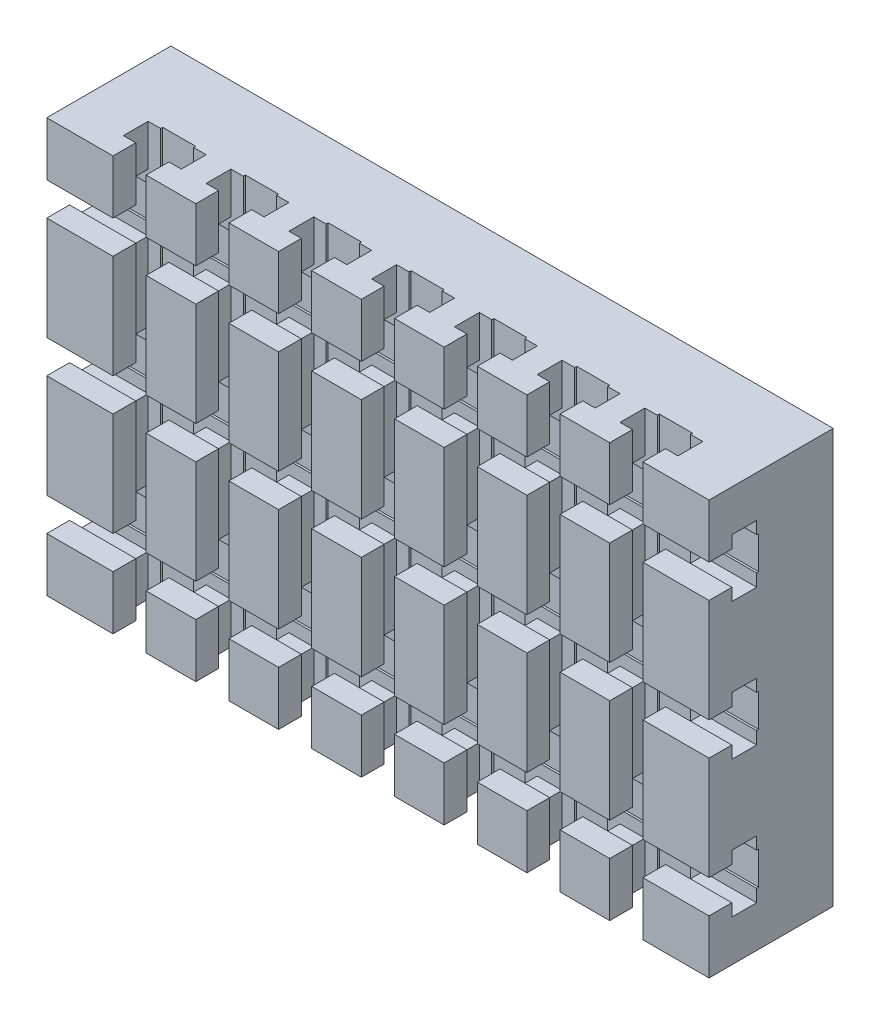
SolidWorks part; units mm, degrees
ref_plane "Front Plane" through (0, 0, 0) normal (0, 0, 1) x (1, 0, 0)
ref_plane "Top Plane" through (0, 0, 0) normal (0, 1, 0) x (1, 0, 0)
ref_plane "Right Plane" through (0, 0, 0) normal (1, 0, 0) x (0, 0, -1)
sketch "Sketch1" plane through (0, 0, 0) normal (0, 0, 1) x (1, 0, 0)
  line L1 (-80, -50) -> (80, -50)
  line L2 (-80, -50) -> (-80, 50)
  line L3 (-80, 50) -> (80, 50)
  line L4 (80, -50) -> (80, 50)
  line L5 (-80, -50) -> (80, 50) construction
  line L6 (-80, 50) -> (80, -50) construction
  point P0 (0, 0)
  dimension "D1" = 160
  dimension "D2" = 100
extrude "Boss-Extrude1" add sketch "Sketch1" along normal blind 30
sketch "Sketch2" plane through (80, 0, 0) normal (1, 0, 0) x (0, 0, -1)
  line L0 (-30, -50) -> (-30, 50) construction
  line L1 (-30, -37) -> (-18, -37)
  line L2 (-30, -37) -> (-30, -29)
  line L3 (-30, -29) -> (-18, -29)
  line L4 (-18, -37) -> (-18, -29)
  line L5 (-30, -4) -> (-18, -4)
  line L6 (-30, -4) -> (-30, 4)
  line L7 (-30, 4) -> (-18, 4)
  line L8 (-18, -4) -> (-18, 4)
  line L9 (-30, 29) -> (-18, 29)
  line L10 (-30, 29) -> (-30, 37)
  line L11 (-30, 37) -> (-18, 37)
  line L12 (-18, 29) -> (-18, 37)
  line L13 (0, 0) -> (-18, 0) construction
  line L14 (-18, -33) -> (-21.5, -33) construction
  line L15 (-24.5, -7) -> (-18.5, -7)
  line L16 (-24.5, -40) -> (-18.5, -40)
  line L17 (-24.5, -40) -> (-24.5, -26)
  line L18 (-24.5, -26) -> (-18.5, -26)
  line L19 (-18.5, -40) -> (-18.5, -26)
  line L20 (-24.5, -40) -> (-18.5, -26) construction
  line L21 (-24.5, -26) -> (-18.5, -40) construction
  line L22 (-18.5, -7) -> (-18.5, 7)
  line L23 (-24.5, 7) -> (-18.5, 7)
  line L24 (-24.5, -7) -> (-24.5, 7)
  line L25 (-24.5, 26) -> (-18.5, 26)
  line L26 (-18.5, 26) -> (-18.5, 40)
  line L27 (-24.5, 40) -> (-18.5, 40)
  line L28 (-24.5, 26) -> (-24.5, 40)
  point P23 (0, 0)
  dimension "D1" = 8
  dimension "D3" = 12
  dimension "D4" = 25
  dimension "D5" = 14
  dimension "D6" = 6
  dimension "D7" = 0.5
  dimension "D2" = 3
  dimension "D8" = 3
extrude "Cut-Extrude1" cut sketch "Sketch2" against normal through all contours L1 L17 L3 M10 | L1 L19 L3 L17 | L16 L19 L1 L17 | L3 L19 L18 L17 | L19 L1 L4 L3 | L24 L5 L22 L7 | L24 L15 L22 L5 | L5 L24 L7 M10 | L24 L7 L22 L23 | L22 L5 L8 L7 | L28 L25 L26 L9 | L28 L9 L26 L11 | L26 L9 L12 L11 | L9 L28 L11 M10 | L28 L11 L26 L27
sketch "Sketch3" plane through (0, -50, 0) normal (0, -1, 0) x (1, 0, 0)
  line L0 (-80, 30) -> (80, 30) construction
  line L1 (-4, 18) -> (4, 18)
  line L2 (-4, 18) -> (-4, 30)
  line L3 (-4, 30) -> (4, 30)
  line L4 (4, 18) -> (4, 30)
  line L5 (-4, 18) -> (4, 30) construction
  line L6 (-4, 30) -> (4, 18) construction
  line L7 (0, 18) -> (0, 21.5) construction
  line L9 (-7, 18.5) -> (7, 18.5)
  line L10 (-7, 18.5) -> (-7, 24.5)
  line L11 (-7, 24.5) -> (7, 24.5)
  line L12 (7, 18.5) -> (7, 24.5)
  line L13 (-7, 18.5) -> (7, 24.5) construction
  line L14 (-7, 24.5) -> (7, 18.5) construction
  point P0 (0, 24)
  dimension "D1" = 12
  dimension "D2" = 8
  dimension "D3" = 6
  dimension "D4" = 0.5
  dimension "D5" = 14
extrude "Cut-Extrude2" cut sketch "Sketch3" against normal through all contours L2 L11 L4 M3 | L11 L2 L9 L4 | L9 L2 L1 L4 | L9 L12 L11 L4 | L11 L10 L9 L2
pattern_linear "LPattern1" count 4 spacing 20 along (-1, 0, 0) count 4 spacing 20 along (1, 0, 0) of "Cut-Extrude2"
